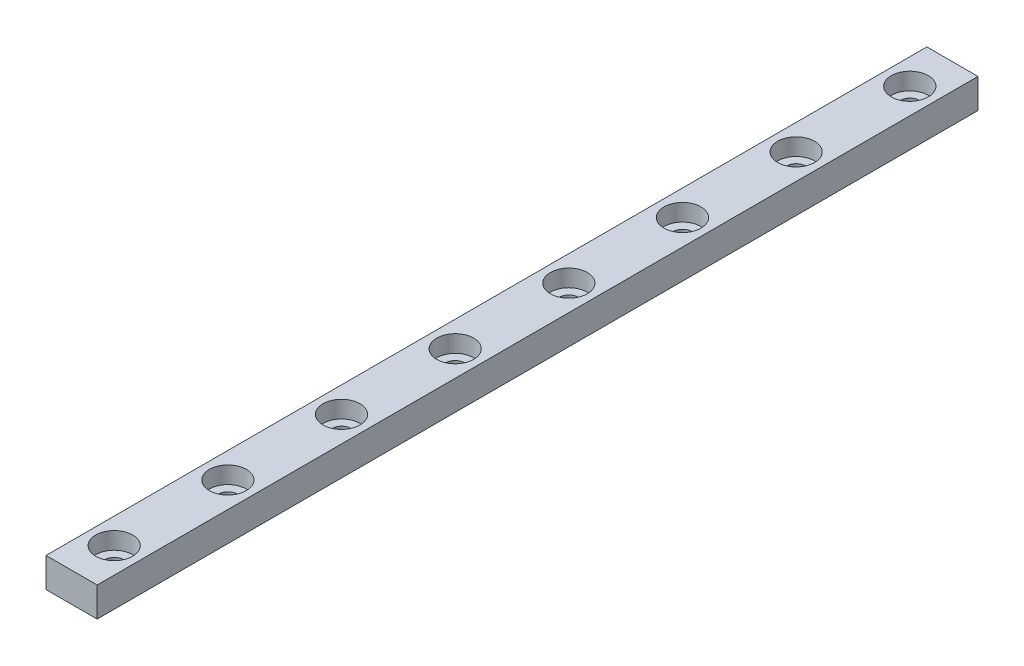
SolidWorks part; units mm, degrees
ref_plane "Front Plane" through (0, 0, 0) normal (0, 0, 1) x (1, 0, 0)
ref_plane "Top Plane" through (0, 0, 0) normal (0, 1, 0) x (1, 0, 0)
ref_plane "Right Plane" through (0, 0, 0) normal (1, 0, 0) x (0, 0, -1)
sketch "Sketch1" plane through (0, 0, 0) normal (1, 0, 0) x (0, 0, -1)
  line L1 (0, 0) -> (155, 0)
  line L2 (0, 0) -> (0, 5.2)
  line L3 (0, 5.2) -> (155, 5.2)
  line L4 (155, 0) -> (155, 5.2)
  dimension "D1" = 155
  dimension "D2" = 5.2
extrude "Boss-Extrude1" add sketch "Sketch1" along normal mid plane 9
hole_wizard "CBORE for M3 SHCS1" positions "Sketch3" profile "Sketch2" counterbore size "M3" standard "ANSI Metric"
sketch "Sketch3" plane through (0, 5.2, 0) normal (0, 1, 0) x (1, 0, 0)
  line L0 (0, 147.5) -> (0, 127.5) construction
  line L1 (0, 127.5) -> (0, 107.5) construction
  line L2 (0, 107.5) -> (0, 87.5) construction
  line L3 (0, 87.5) -> (0, 67.5) construction
  line L4 (0, 67.5) -> (0, 47.5) construction
  line L5 (0, 47.5) -> (0, 27.5) construction
  line L6 (0, 27.5) -> (0, 7.5) construction
  line L8 (4.5, 155) -> (-4.5, 155) construction
  line L9 (-4.5, 155) -> (-4.5, 0) construction
  point P0 (0, 87.5)
  point P1 (0, 147.5)
  point P3 (0, 127.5)
  point P5 (0, 107.5)
  point P7 (0, 67.5)
  point P9 (0, 47.5)
  point P11 (0, 27.5)
  point P13 (0, 7.5)
  dimension "D1" = 20
  dimension "D2" = 7.5
  dimension "D3" = 4.5
sketch "Sketch2" plane through (0, 5.2, -87.5) normal (1, 0, 0) x (0, 0, 1)
  line L0 (0, 0) -> (0, 5.2)
  line L1 (0, 5.2) -> (1.7, 5.2)
  line L3 (1.7, 5.2) -> (1.7, 3)
  line L4 (1.7, 3) -> (3.25, 3)
  line L5 (3.25, 3) -> (3.25, 0)
  line L7 (3.25, 0) -> (0, 0)
  line L11 (0, -6.35) -> (0, 107.95) construction
  dimension "Thru Hole Dia." = 3.4
  dimension "Thru Hole Depth" = 5.2
  dimension "C'Bore Dia." = 6.5
  dimension "C'Bore Depth" = 3
